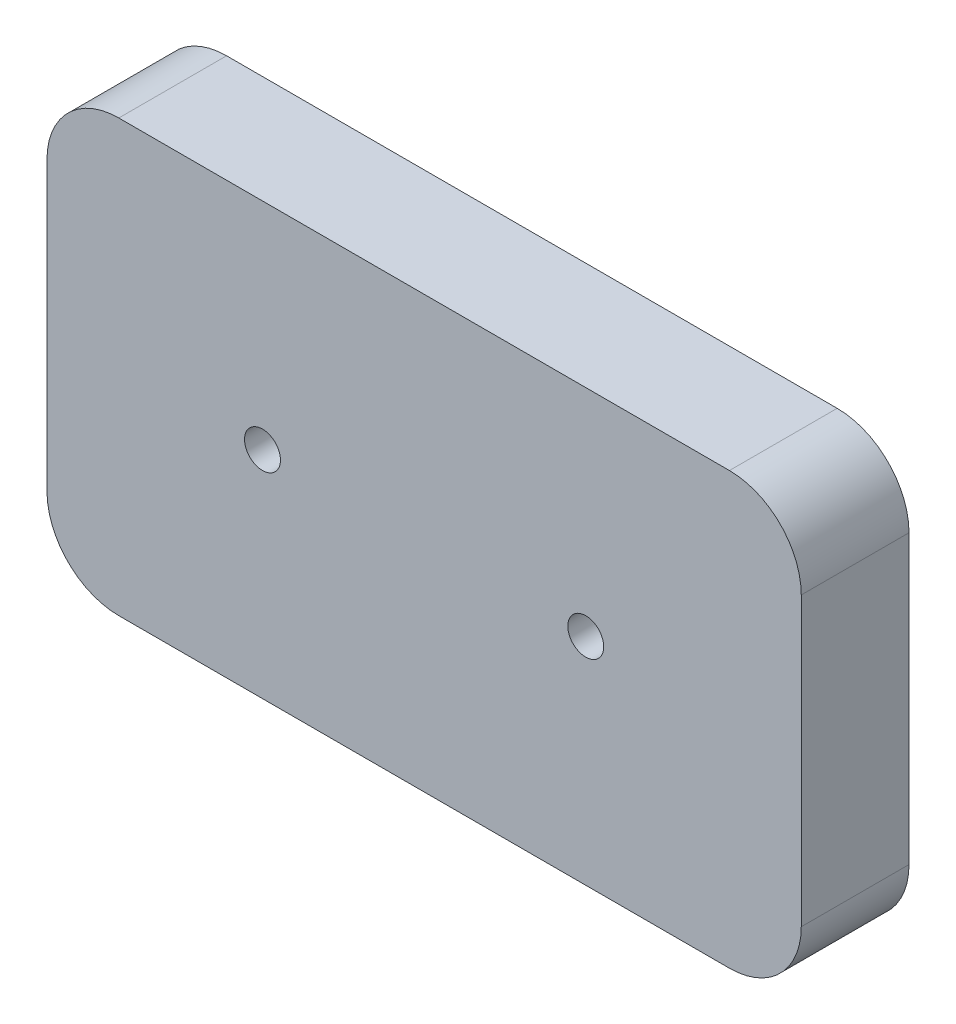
SolidWorks part; units mm, degrees
ref_plane "Plan de face" through (0, 0, 0) normal (0, 0, 1) x (1, 0, 0)
ref_plane "Plan de dessus" through (0, 0, 0) normal (0, 1, 0) x (1, 0, 0)
ref_plane "Plan de droite" through (0, 0, 0) normal (1, 0, 0) x (0, 0, -1)
sketch "Esquisse4" plane through (0, 0, 0) normal (0, 0, 1) x (1, 0, 0)
  line L1 (-8.5, -6) -> (8.5, -6)
  line L2 (-10.5, -4) -> (-10.5, 4)
  line L3 (-8.5, 6) -> (8.5, 6)
  line L4 (10.5, -4) -> (10.5, 4)
  line L5 (-10.5, -6) -> (10.5, 6) construction
  line L6 (-10.5, 6) -> (10.5, -6) construction
  arc A0 (-8.5, -6) -> (-10.5, -4) centre (-8.5, -4) cw
  arc A1 (8.5, -6) -> (10.5, -4) centre (8.5, -4) ccw
  arc A2 (8.5, 6) -> (10.5, 4) centre (8.5, 4) cw
  arc A3 (-10.5, 4) -> (-8.5, 6) centre (-8.5, 4) cw
  dimension "D3" = 2
  dimension "D1" = 12
  dimension "D2" = 21
extrude "Boss.-Extru.3" add sketch "Esquisse4" against normal blind 3
sketch "Esquisse8" plane through (0, 0, -3) normal (0, 0, -1) x (-1, 0, 0)
  line L1 (-8.5, -5) -> (8.5, -5)
  line L2 (-9.5, -4) -> (-9.5, 4)
  line L3 (-8.5, 5) -> (8.5, 5)
  line L4 (9.5, -4) -> (9.5, 4)
  line L5 (-9.5, -5) -> (9.5, 5) construction
  line L6 (-9.5, 5) -> (9.5, -5) construction
  arc A0 (8.5, 5) -> (9.5, 4) centre (8.5, 4) cw
  arc A1 (8.5, -5) -> (9.5, -4) centre (8.5, -4) ccw
  arc A2 (-8.5, -5) -> (-9.5, -4) centre (-8.5, -4) cw
  arc A3 (-9.5, 4) -> (-8.5, 5) centre (-8.5, 4) cw
  point P0 (0, 0)
  dimension "D3" = 1
  dimension "D1" = 10
  dimension "D2" = 19
extrude "Enlèv. mat.-Extru.4" cut sketch "Esquisse8" against normal blind 1.7
sketch "Esquisse9" plane through (0, 0, -1.3) normal (0, 0, -1) x (-1, 0, 0)
  circle A0 centre (4.5, 0) radius 0.5
  circle A1 centre (-4.5, 0) radius 0.5
  dimension "D1" = 4.5
  dimension "D2" = 4.5
extrude "Enlèv. mat.-Extru.5" cut sketch "Esquisse9" against normal through all
ref_point "Point1"
